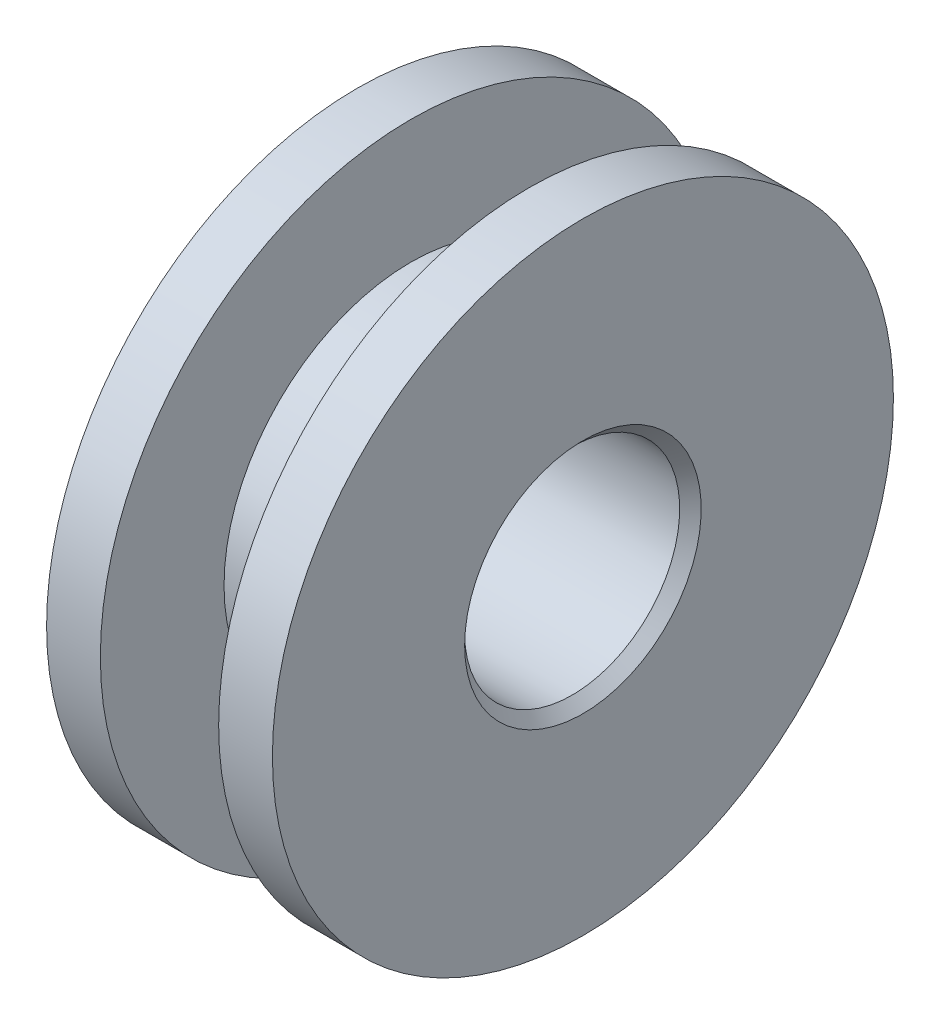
SolidWorks part; units mm, degrees
ref_plane "Front" through (0, 0, 0) normal (0, 0, 1) x (1, 0, 0)
ref_plane "Top" through (0, 0, 0) normal (0, 1, 0) x (1, 0, 0)
ref_plane "Right" through (0, 0, 0) normal (1, 0, 0) x (0, 0, -1)
sketch "Sketch2" plane through (0, 0, 0) normal (0, 0, 1) x (1, 0, 0)
  line L0 (0, 5) -> (0, 14.436)
  line L1 (0, 14.436) -> (2.5, 14.436)
  line L2 (2.5, 14.436) -> (2.5, 8.686)
  line L3 (2.5, 8.686) -> (8, 8.686)
  line L4 (8, 8.686) -> (8, 14.436)
  line L5 (8, 14.436) -> (10.5, 14.436)
  line L6 (10.5, 14.436) -> (10.5, 5)
  line L7 (0, 0) -> (15.6808, 0) construction
  line L8 (0, 5) -> (10.5, 5)
  dimension "D1" = 5
  dimension "D4" = 5.5
  dimension "D5" = 2.5
  dimension "D6" = 2.5
revolve "Revolve1" add sketch "Sketch2" angle 360 about L7
chamfer "Chamfer1" distance 0.5 angle 45 2 edges at (0, 0, 5) (10.5, 0, 5)
